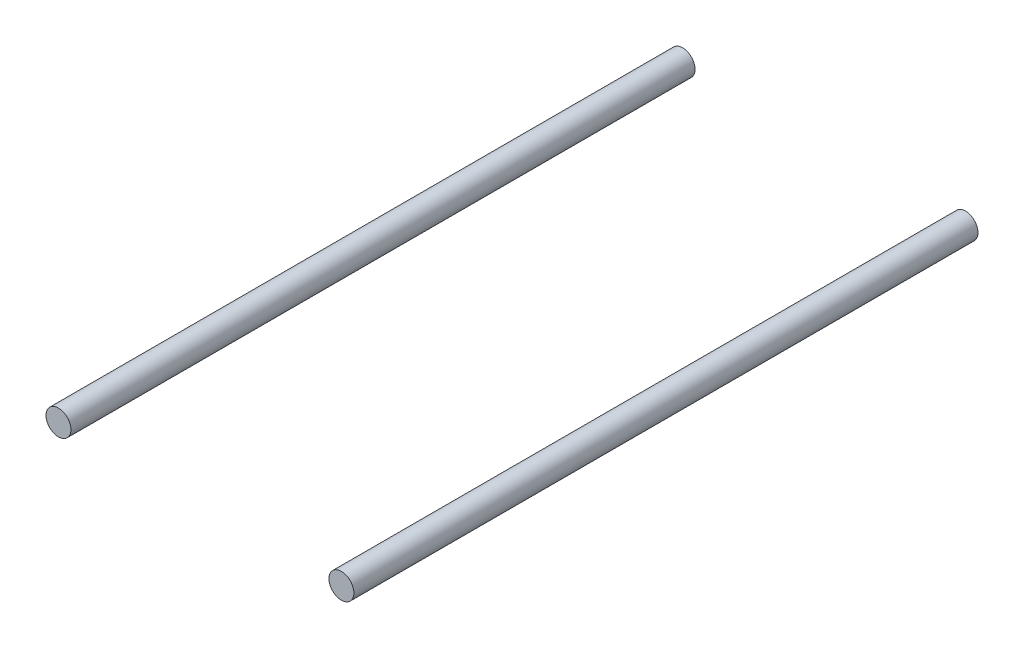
SolidWorks part; units mm, degrees
ref_plane "Plan de face" through (0, 0, 0) normal (0, 0, 1) x (1, 0, 0)
ref_plane "Plan de dessus" through (0, 0, 0) normal (0, 1, 0) x (1, 0, 0)
ref_plane "Plan de droite" through (0, 0, 0) normal (1, 0, 0) x (0, 0, -1)
sketch "Esquisse1" plane through (0, 0, 0) normal (0, 0, 1) x (1, 0, 0)
  circle A0 centre (8, 7.5) radius 1.5
  circle A1 centre (42, 7.5) radius 1.5
  dimension "D4" = 3
  dimension "D5" = 3
extrude "Extrusion1" add sketch "Esquisse1" along normal blind 10 and the other way blind 65
